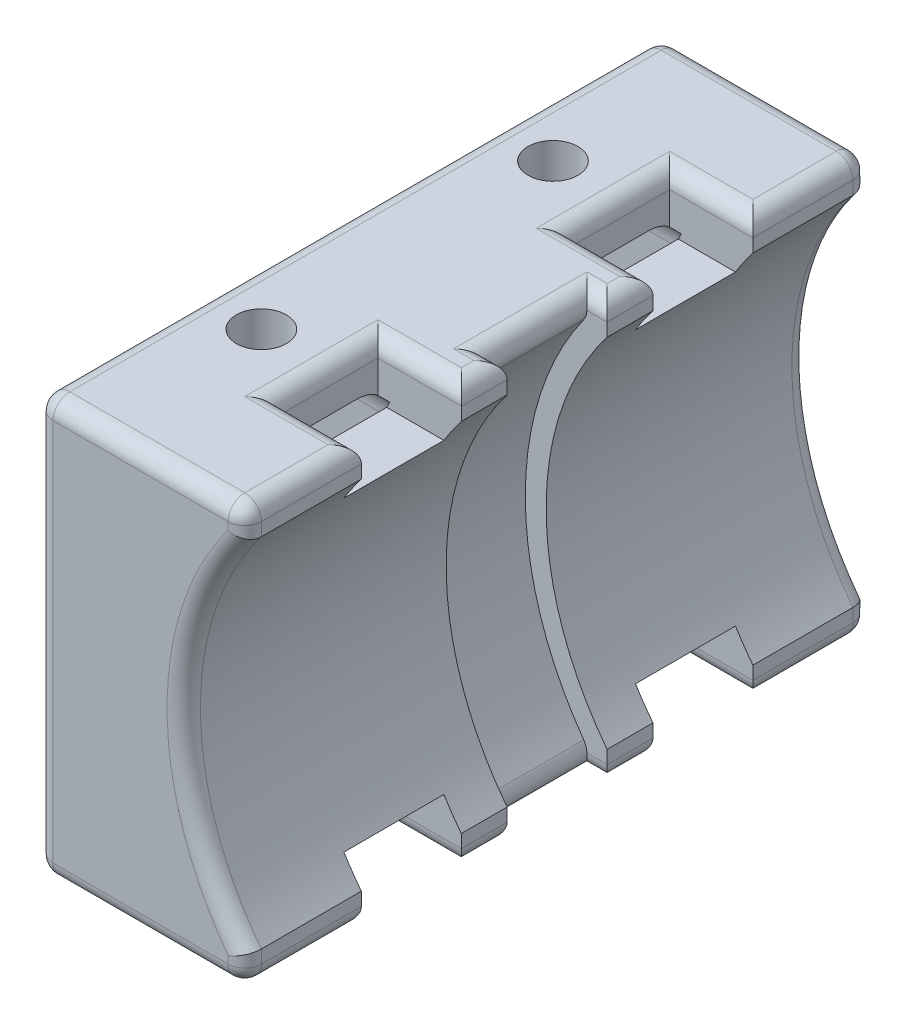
SolidWorks part; units mm, degrees
ref_plane "Front" through (0, 0, 0) normal (0, 0, 1) x (1, 0, 0)
ref_plane "Top" through (0, 0, 0) normal (0, 1, 0) x (1, 0, 0)
ref_plane "Right" through (0, 0, 0) normal (1, 0, 0) x (0, 0, -1)
sketch "Sketch1" plane through (0, 0, 0) normal (1, 0, 0) x (0, 0, -1)
  line L1 (0, -31.75) -> (95.25, -31.75)
  line L2 (0, -31.75) -> (0, 31.75)
  line L3 (0, 31.75) -> (95.25, 31.75)
  line L4 (95.25, -31.75) -> (95.25, 31.75)
  dimension "D1" = 95.25
  dimension "D3" = 31.75
extrude "Boss-Extrude1" add sketch "Sketch1" along normal blind 31.75
sketch "Sketch2" plane through (0, 0, 0) normal (0, 0, 1) x (1, 0, 0)
  line L0 (66.9036, 0) -> (0, 0) construction
  line L1 (0, 0) -> (-116.9937, 66.8779) construction
  circle A0 centre (66.9036, 0) radius 44.45
  dimension "D1" = 88.9
  dimension "D2" = 66.9036
extrude "Cut-Extrude1" cut sketch "Sketch2" against normal through all
sketch "Sketch3" plane through (0, 0, 0) normal (-1, 0, 0) x (0, 0, 1)
  line L0 (-95.25, 0) -> (0, 0) construction
  line L1 (-74.295, 25.4) -> (-65.405, 25.4)
  line L2 (-79.375, 20.32) -> (-79.375, -20.32)
  line L3 (-74.295, -25.4) -> (-65.405, -25.4)
  line L4 (-60.325, 20.32) -> (-60.325, -20.32)
  line L5 (-34.925, 20.32) -> (-34.925, -20.32)
  line L6 (-20.955, -25.4) -> (-29.845, -25.4)
  line L7 (-15.875, 20.32) -> (-15.875, -20.32)
  line L8 (-20.955, 25.4) -> (-29.845, 25.4)
  line L9 (0, 0) -> (-47.625, 0) construction
  line L10 (-47.625, 0) -> (-47.625, 29.8303) construction
  line L11 (0, 31.75) -> (0, -31.75) construction
  arc A0 (-79.375, -20.32) -> (-74.295, -25.4) centre (-74.295, -20.32) ccw
  arc A1 (-65.405, -25.4) -> (-60.325, -20.32) centre (-65.405, -20.32) ccw
  arc A2 (-60.325, 20.32) -> (-65.405, 25.4) centre (-65.405, 20.32) ccw
  arc A3 (-79.375, 20.32) -> (-74.295, 25.4) centre (-74.295, 20.32) cw
  arc A4 (-15.875, 20.32) -> (-20.955, 25.4) centre (-20.955, 20.32) ccw
  arc A5 (-34.925, 20.32) -> (-29.845, 25.4) centre (-29.845, 20.32) cw
  arc A6 (-29.845, -25.4) -> (-34.925, -20.32) centre (-29.845, -20.32) cw
  arc A7 (-15.875, -20.32) -> (-20.955, -25.4) centre (-20.955, -20.32) cw
  dimension "D6" = 5.08
  dimension "D1" = 19.05
  dimension "D2" = 50.8
  dimension "D3" = 25.4
  dimension "D4" = 47.625
  dimension "D5" = 12.7
extrude "Cut-Extrude2" cut sketch "Sketch3" against normal offset from surface (18.9622 mm away) 7.62
sketch "Sketch4" plane through (0, 31.75, 0) normal (0, 1, 0) x (1, 0, 0)
  line L3 (8.89, 69.85) -> (8.89, 25.4) construction
  line L4 (0, 95.25) -> (0, 0) construction
  line L5 (0, 47.625) -> (18.6269, 47.625) construction
  circle A0 centre (8.89, 69.85) radius 3.81
  circle A1 centre (8.89, 25.4) radius 3.81
  dimension "D1" = 7.62
  dimension "D5" = 7.62
  dimension "D2" = 8.89
  dimension "D3" = 22.225
  dimension "D4" = 44.45
extrude "Cut-Extrude3" cut sketch "Sketch4" against normal blind 15.24
ref_plane "Plane1" through (0, 0, -47.625) normal (0, 0, 1) x (1, 0, 0)
sketch "Sketch5" plane through (0, 0, -47.625) normal (0, 0, 1) x (1, 0, 0)
  circle A0 centre (66.9036, 0) radius 47.625
  arc A1 (31.75, 27.2034) -> (31.75, -27.2034) centre (66.9036, 0) ccw construction
  point P2 (22.4536, 0)
  dimension "D1" = 44.45
extrude "Cut-Extrude4" cut sketch "Sketch5" against normal blind 7.62 and the other way blind 7.62
sketch "Sketch6" plane through (0, -31.75, 0) normal (0, -1, 0) x (1, 0, 0)
  line L1 (19.05, -17.78) -> (31.75, -17.78)
  line L2 (19.05, -17.78) -> (19.05, -33.02)
  line L3 (19.05, -33.02) -> (31.75, -33.02)
  line L4 (31.75, -17.78) -> (31.75, -33.02)
  line L6 (31.75, 0) -> (0, 0) construction
  line L7 (31.75, 0) -> (31.75, -40.005) construction
  line L8 (0, -47.625) -> (31.406, -47.625) construction
  line L9 (17.4625, -47.625) -> (-17.4625, -47.625) construction
  line L10 (31.406, -40.005) -> (31.406, -55.245) construction
  line L11 (31.75, -77.47) -> (31.75, -62.23)
  line L12 (19.05, -62.23) -> (31.75, -62.23)
  line L13 (19.05, -77.47) -> (19.05, -62.23)
  line L14 (19.05, -77.47) -> (31.75, -77.47)
  point P18 (19.05, -25.4)
  dimension "D1" = 17.78
  dimension "D2" = 12.7
  dimension "D3" = 15.24
  dimension "D4" = 14.605
  dimension "D5" = 22.225
extrude "Cut-Extrude5" cut sketch "Sketch6" against normal blind 8.382
mirror "Mirror1" about plane through (0, 0, 0) normal (0, 1, 0) of "Cut-Extrude5"
hole_wizard "1/4-20 Tapped Hole1" positions "Sketch8" profile "Sketch7" tap size "1/4-20" standard "ANSI Inch"
sketch "Sketch8" plane through (0, 0, 0) normal (-1, 0, 0) x (0, 0, 1)
  line L0 (-47.625, -17.4625) -> (-47.625, 17.4625) construction
  line L1 (-40.005, 0) -> (-55.245, 0) construction
  line L2 (-85.725, 22.225) -> (-9.525, 22.225) construction
  line L3 (-9.525, 22.225) -> (-9.525, -22.225) construction
  line L4 (-9.525, -22.225) -> (-85.725, -22.225) construction
  line L5 (-85.725, -22.225) -> (-85.725, 22.225) construction
  point P0 (-85.725, 22.225)
  point P2 (-85.725, -22.225)
  point P4 (-47.625, 0)
  point P10 (-47.625, -12.7)
  point P12 (-47.625, 12.7)
  point P14 (-9.525, 22.225)
  point P16 (-9.525, -22.225)
  dimension "D1" = 22.225
  dimension "D2" = 44.45
  dimension "D3" = 38.1
  dimension "D4" = 76.2
  dimension "D5" = 12.7
  dimension "D6" = 25.4
sketch "Sketch7" plane through (0, 22.225, -85.725) normal (0, 1, 0) x (0, 0, 1)
  line L0 (0, 0) -> (0, 18.0438)
  line L1 (0, 18.0438) -> (2.5527, 16.51)
  line L2 (2.5527, 16.51) -> (2.5527, 0)
  line L5 (2.5527, 0) -> (0, 0)
  line L10 (0, 18.0438) -> (-2.5527, 16.51) construction
  line L11 (0, -6.35) -> (0, 107.95) construction
  dimension "Tap Drill Dia." = 5.1054
  dimension "Tap Drill Depth" = 16.51
  dimension "Drill Angle" = 118
fillet "Fillet1" radius 2.54 40 edges at (31.75, 31.75, -86.36) (19.05, 31.75, -69.85) (25.4, 31.75, -62.23) (31.75, 31.75, -58.7375) (31.578, 31.75, -55.245) (31.406, 31.75, -47.625) (31.578, 31.75, -40.005) (31.75, 31.75, -36.5125) (25.4, 31.75, -33.02) (19.05, 31.75, -25.4) (25.4, 31.75, -17.78) (31.75, 31.75, -8.89) (15.875, 31.75, 0) (0, 31.75, -47.625) (15.875, 31.75, -95.25) (25.4, 31.75, -77.47) (15.875, -31.75, -95.25) (0, -31.75, -47.625) (15.875, -31.75, 0) (31.75, -31.75, -8.89) (25.4, -31.75, -17.78) (19.05, -31.75, -25.4) (25.4, -31.75, -33.02) (31.75, -31.75, -36.5125) (31.578, -31.75, -40.005) (31.406, -31.75, -47.625) (31.578, -31.75, -55.245) (31.75, -31.75, -58.7375) (25.4, -31.75, -62.23) (19.05, -31.75, -69.85) (25.4, -31.75, -77.47) (31.75, -31.75, -86.36) (0, 0, -95.25) (31.75, -29.4767, -95.25) (22.4536, 0, -95.25) (31.75, 29.4767, -95.25) (0, 0, 0) (31.75, 29.4767, 0) (22.4536, 0, 0) (31.75, -29.4767, 0)
ref_plane "Plane2" through (0, 0, 0) normal (0, 1, 0) x (1, 0, 0)
